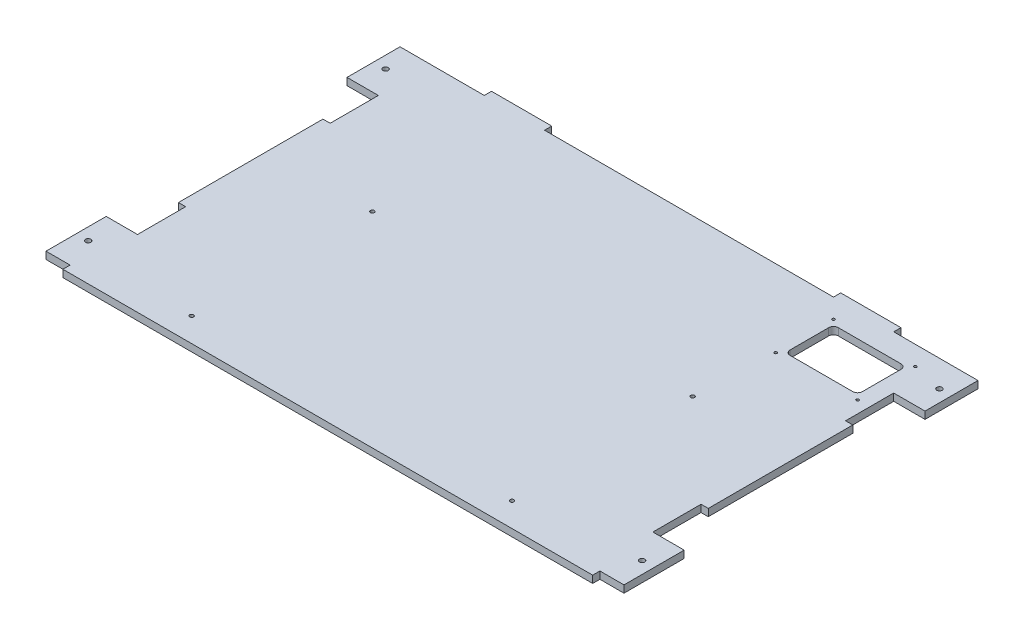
SolidWorks part; units mm, degrees
ref_plane "Ebene vorne" through (0, 0, 0) normal (0, 0, 1) x (1, 0, 0)
ref_plane "Ebene oben" through (0, 0, 0) normal (0, 1, 0) x (1, 0, 0)
ref_plane "Ebene rechts" through (0, 0, 0) normal (1, 0, 0) x (0, 0, -1)
sketch "Skizze1" plane through (0, 0, 0) normal (0, 1, 0) x (1, 0, 0)
  line L0 (0, 196.702) -> (0, -72.2048) construction
  line L1 (-79.6855, 0) -> (86.1904, 0) construction
  line L2 (-220, 150) -> (-170, 150)
  line L3 (170, 150) -> (220, 150)
  line L4 (-220, 66) -> (-220, -54)
  line L5 (-220, -150) -> (220, -150)
  line L6 (120, 150) -> (120, 156)
  line L7 (220, 150) -> (240, 150)
  line L8 (-170, 150) -> (-170, 156)
  line L9 (-170, 156) -> (-120, 156)
  line L10 (-120, 150) -> (-120, 156)
  line L11 (-120, 150) -> (120, 150)
  line L12 (170, 150) -> (170, 156)
  line L13 (170, 156) -> (120, 156)
  line L14 (240, 150) -> (240, 106)
  line L15 (220, -150) -> (220, -144)
  line L16 (240, 106) -> (220, 106)
  line L17 (-240, 106) -> (-220, 106)
  line L18 (-240, 150) -> (-240, 106)
  line L19 (-220, 150) -> (-240, 150)
  line L20 (-220, -144) -> (-220, -150)
  line L21 (-220, -144) -> (-240, -144)
  line L22 (220, -144) -> (240, -144)
  line L23 (-220, -94) -> (-240, -94)
  line L24 (-240, -144) -> (-240, -94)
  line L25 (220, -94) -> (240, -94)
  line L26 (240, -144) -> (240, -94)
  line L27 (220, -54) -> (220, 66)
  line L28 (214, -94) -> (214, -54)
  line L29 (-220, -94) -> (-214, -94)
  line L30 (220, -54) -> (214, -54)
  line L31 (-220, -54) -> (-214, -54)
  line L32 (-214, -94) -> (-214, -54)
  line L33 (220, -94) -> (214, -94)
  line L34 (214, 106) -> (214, 66)
  line L35 (-220, 106) -> (-214, 106)
  line L36 (-230, -144) -> (-230, 150) construction
  line L37 (-220, 66) -> (-214, 66)
  line L38 (-214, 106) -> (-214, 66)
  line L39 (220, 66) -> (214, 66)
  line L40 (220, 106) -> (214, 106)
  line L41 (-240, -119) -> (-220, -119) construction
  line L42 (-240, 128) -> (-220, 128) construction
  line L43 (170, 90) -> (170, 130) construction
  line L44 (144, 90) -> (196, 90)
  line L45 (140, 94) -> (140, 126)
  line L46 (144, 130) -> (196, 130)
  line L47 (200, 94) -> (200, 126)
  line L48 (140, 110) -> (200, 110) construction
  circle A0 centre (-230, -119) radius 2.2
  circle A1 centre (-230, 128) radius 2.2
  circle A2 centre (230, -119) radius 2.2
  circle A3 centre (230, 128) radius 2.2
  arc A4 (140, 126) -> (144, 130) centre (144, 126) cw
  arc A5 (196, 130) -> (200, 126) centre (196, 126) cw
  arc A6 (196, 90) -> (200, 94) centre (196, 94) ccw
  arc A7 (144, 90) -> (140, 94) centre (144, 94) cw
  circle A8 centre (136, 86) radius 1.1
  circle A9 centre (204, 86) radius 1.1
  circle A10 centre (136, 134) radius 1.1
  circle A11 centre (204, 134) radius 1.1
  circle A12 centre (-133, -130) radius 1.6
  circle A13 centre (-133, 20) radius 1.6
  circle A14 centre (133, 20) radius 1.6
  circle A15 centre (133, -130) radius 1.6
  point P14 (0, 150)
  point P64 (140, 130)
  point P69 (200, 90)
  point P72 (140, 90)
  dimension "D14" = 4.4
  dimension "D17" = 4
  dimension "D20" = 2.2
  dimension "D25" = 3.2
  dimension "D1" = 6
  dimension "D2" = 440
  dimension "D3" = 50
  dimension "D4" = 50
  dimension "D5" = 300
  dimension "D6" = 20
  dimension "D7" = 44
  dimension "D8" = 6
  dimension "D9" = 20
  dimension "D10" = 50
  dimension "D11" = 6
  dimension "D12" = 40
  dimension "D13" = 40
  dimension "D15" = 60
  dimension "D16" = 40
  dimension "D18" = 20
  dimension "D19" = 20
  dimension "D21" = 8
  dimension "D22" = 8
  dimension "D23" = 68
  dimension "D24" = 48
  dimension "D26" = 20
  dimension "D27" = 150
  dimension "D28" = 266
extrude "Aufsatz-Linear austragen1" add sketch "Skizze1" along normal blind 6
